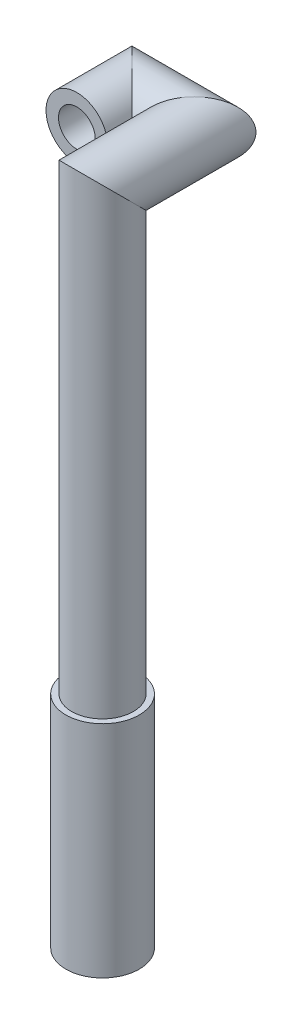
SolidWorks part; units mm, degrees
ref_plane "Front Plane" through (0, 0, 0) normal (0, 0, 1) x (1, 0, 0)
ref_plane "Top Plane" through (0, 0, 0) normal (0, 1, 0) x (1, 0, 0)
ref_plane "Right Plane" through (0, 0, 0) normal (1, 0, 0) x (0, 0, -1)
sketch "Sketch1" plane through (0, 0, 0) normal (0, 1, 0) x (1, 0, 0)
  circle A0 centre (0, 0) radius 12.7
  circle A1 centre (0, 0) radius 6.35
  dimension "D1" = 25.4
  dimension "D2" = 12.7
extrude "Boss-Extrude1" add sketch "Sketch1" along normal blind 38.1
sketch "Sketch2" plane through (0, 38.1, 0) normal (0, 1, 0) x (1, 0, 0)
  circle A0 centre (0, 0) radius 10.668
  dimension "D1" = 21.336
extrude "Cut-Extrude1" cut sketch "Sketch2" against normal blind 25.4
mirror "Mirror2" about plane through (0, 0, 0) normal (0, 1, 0) of "Cut-Extrude1", "Boss-Extrude1"
sketch "Sketch4" plane through (0, 38.1, 0) normal (0, 1, 0) x (1, 0, 0)
  circle A4 centre (0, 0) radius 6.35 construction
  circle A5 centre (0, 0) radius 6.35
  circle A6 centre (0, 0) radius 10.668 construction
  circle A7 centre (0, 0) radius 10.668
extrude "Boss-Extrude3" add sketch "Sketch4" along normal blind 76.2 and the other way up to surface
sketch "Sketch5" plane through (0, 114.3, 0) normal (0, 1, 0) x (1, 0, 0)
  circle A0 centre (0, 0) radius 10.668 construction
  circle A1 centre (0, 0) radius 6.35 construction
  circle A2 centre (0, 0) radius 10.668
  circle A3 centre (0, 0) radius 6.35
  point P6 (0, 0)
sketch3d "3DSketch2"
  line L0 (0, 114.3, 0) -> (0, 190.5, 0)
  line L1 (0, 190.5, 0) -> (0, 190.5, -31.75)
  line L2 (0, 190.5, -31.75) -> (-21.59, 190.5, -31.75)
  line L3 (-21.59, 190.5, -31.75) -> (-21.59, 190.5, -12.7)
  dimension "D1" = 76.2
  dimension "2" = 31.75
  dimension "D3" = 21.59
  dimension "D4" = 19.05
sweep "Sweep1" add profiles "Sketch5" path "3DSketch2"
